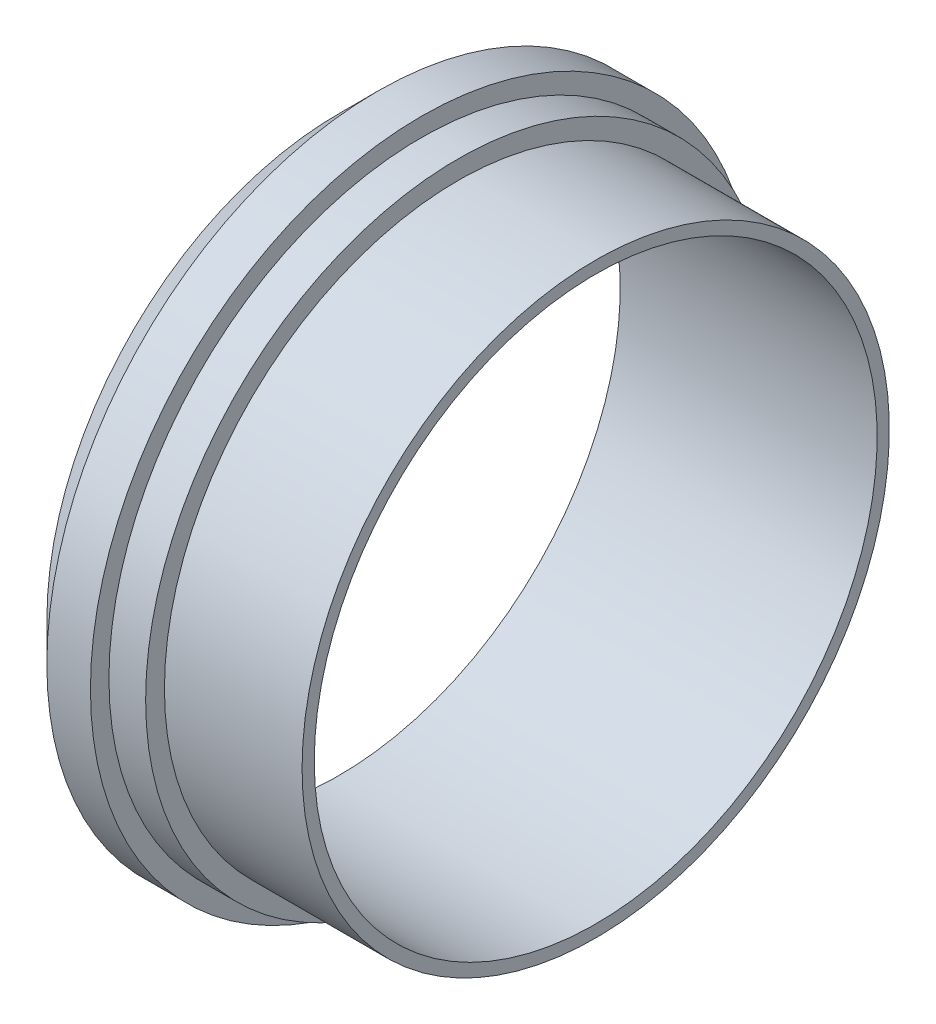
SolidWorks part; units mm, degrees
ref_plane "Front Plane" through (0, 0, 0) normal (0, 0, 1) x (1, 0, 0)
ref_plane "Top Plane" through (0, 0, 0) normal (0, 1, 0) x (1, 0, 0)
ref_plane "Right Plane" through (0, 0, 0) normal (1, 0, 0) x (0, 0, -1)
sketch "Sketch1" plane through (0, 0, 0) normal (0, 0, 1) x (1, 0, 0)
  line L0 (0, 0) -> (-23.8125, 0)
  line L1 (-23.8125, 0) -> (-23.8125, -3.2512)
  line L2 (-23.8125, -3.2512) -> (-30.1625, -3.2512)
  line L3 (-30.1625, -3.2512) -> (-30.1625, -6.4516)
  line L4 (-30.1625, -6.4516) -> (-37.7038, -6.4516)
  line L5 (-37.7038, -6.4516) -> (-44.45, 0.3048)
  line L6 (-44.45, 0.3048) -> (-44.45, 50.8)
  line L7 (-44.45, 50.8) -> (0, 50.8)
  line L8 (0, 50.8) -> (0, 0)
  dimension "D1" = 50.8
  dimension "D2" = 44.45
  dimension "D3" = 6.35
  dimension "D4" = 7.5413
  dimension "D5" = 6.7462
  dimension "D6" = 50.4952
  dimension "D7" = 57.2516
  dimension "D8" = 54.0512
revolve "Revolve1" add sketch "Sketch1" angle 360 about L7
sketch "Sketch4" plane through (-44.45, 0, 0) normal (-1, 0, 0) x (0, 0, 1)
  circle A0 centre (0, 50.8) radius 48.6918
extrude "Cut-Extrude1" cut sketch "Sketch4" against normal blind 44.45 contours A0
